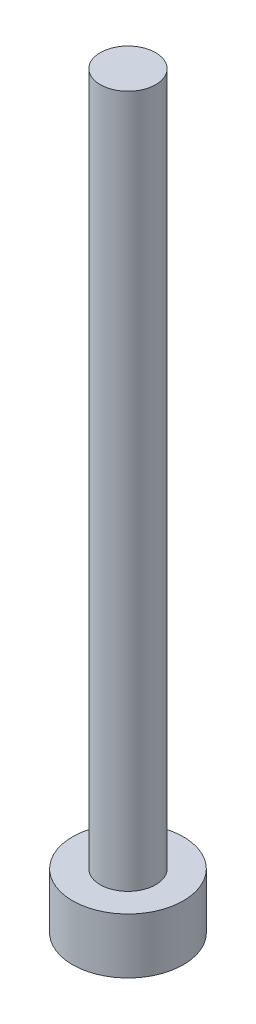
SolidWorks part; units mm, degrees
ref_plane "Face" through (0, 0, 0) normal (0, 0, 1) x (1, 0, 0)
ref_plane "Dessus" through (0, 0, 0) normal (0, 1, 0) x (1, 0, 0)
ref_plane "Droite" through (0, 0, 0) normal (1, 0, 0) x (0, 0, -1)
sketch "Esquisse1" plane through (0, 0, 0) normal (0, 0, 1) x (1, 0, 0)
  line L0 (0, 49.4323) -> (0, -48.5112) construction
  line L1 (0, 0) -> (-4, 0)
  line L2 (-4, 0) -> (-4, 4)
  line L3 (-4, 4) -> (-2, 4)
  line L4 (-2, 4) -> (-2, 54)
  line L5 (-2, 54) -> (0, 54)
  line L6 (0, 54) -> (0, 0)
  dimension "D1" = 54
  dimension "D2" = 4
  dimension "D3" = 8
  dimension "D4" = 2
revolve "Base-Révolution" add sketch "Esquisse1" angle 360 about L0
